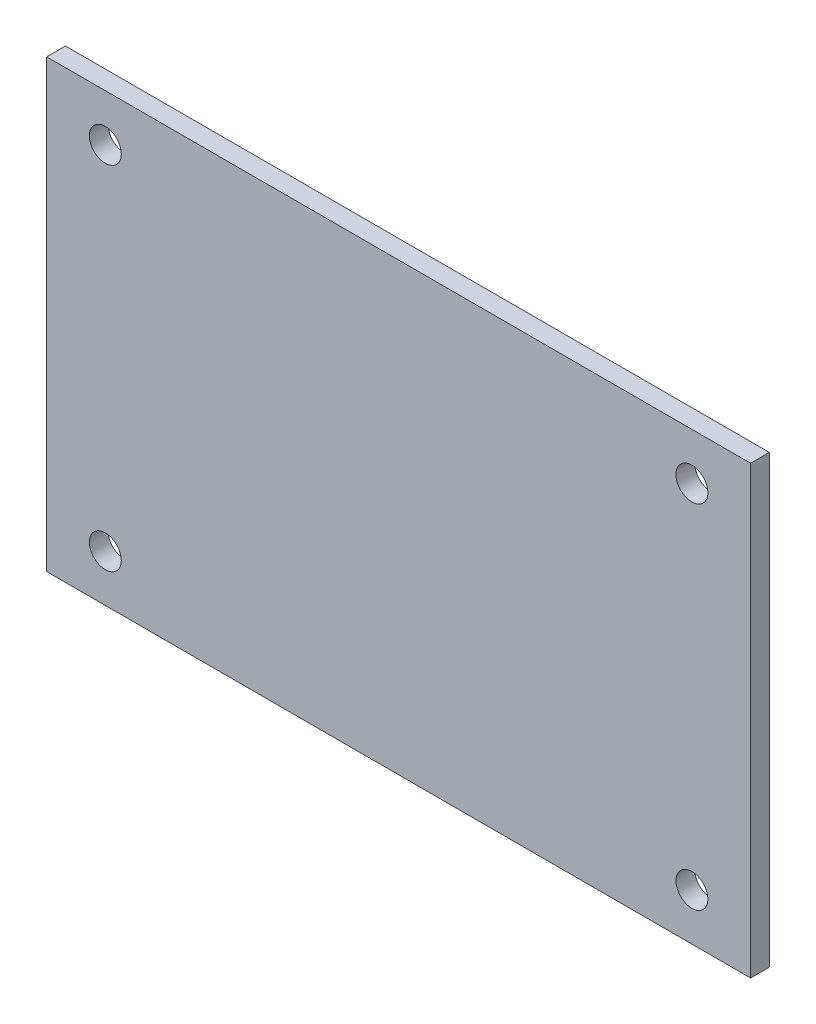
SolidWorks part; units mm, degrees
ref_plane "Plan de face" through (0, 0, 0) normal (0, 0, 1) x (1, 0, 0)
ref_plane "Plan de dessus" through (0, 0, 0) normal (0, 1, 0) x (1, 0, 0)
ref_plane "Plan de droite" through (0, 0, 0) normal (1, 0, 0) x (0, 0, -1)
sketch "Esquisse2" plane through (0, 0, 0) normal (0, 0, 1) x (1, 0, 0)
  line L1 (-75, 95) -> (75, 95)
  line L2 (-75, 95) -> (-75, 0)
  line L3 (-75, 0) -> (75, 0)
  line L4 (75, 95) -> (75, 0)
  circle A0 centre (-62.5, 10) radius 3.4
  circle A1 centre (-62.5, 85) radius 3.4
  circle A2 centre (62.5, 10) radius 3.4
  circle A3 centre (62.5, 85) radius 3.4
  dimension "D7" = 6.8
  dimension "D8" = 6.8
  dimension "D9" = 6.8
  dimension "D10" = 6.8
  dimension "D1" = 150
  dimension "D2" = 125
  dimension "D3" = 12.5
  dimension "D4" = 10
  dimension "D5" = 75
  dimension "D6" = 95
extrude "Extrusion1" add sketch "Esquisse2" against normal blind 4
